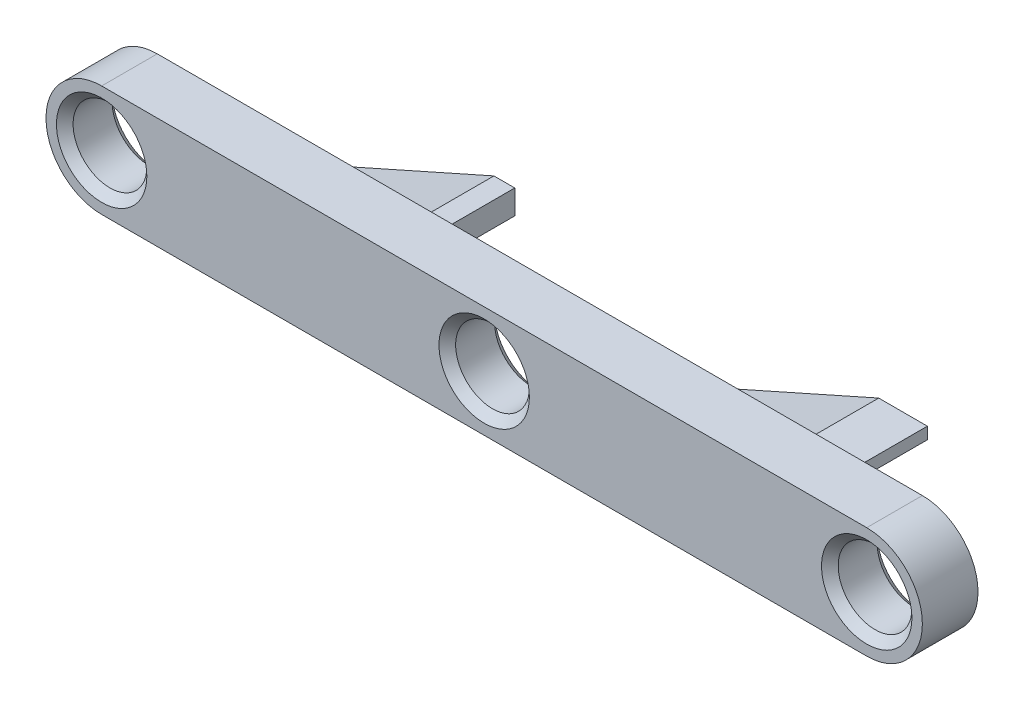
SolidWorks part; units mm, degrees
ref_plane "Alzado" through (0, 0, 0) normal (0, 0, 1) x (1, 0, 0)
ref_plane "Planta" through (0, 0, 0) normal (0, 1, 0) x (1, 0, 0)
ref_plane "Vista lateral" through (0, 0, 0) normal (1, 0, 0) x (0, 0, -1)
sketch "Sketch1" plane through (0, 0, 0) normal (0, 0, 1) x (1, 0, 0)
  line L0 (-27.5, 0) -> (27.5, 0) construction
  line L1 (-27.5, 4) -> (27.5, 4)
  line L2 (-27.5, -4) -> (27.5, -4)
  arc A0 (-27.5, 4) -> (-27.5, -4) centre (-27.5, 0) ccw
  arc A1 (27.5, -4) -> (27.5, 4) centre (27.5, 0) ccw
  point P3 (0, 0)
extrude "Boss-Extrude1" add sketch "Sketch1" along normal blind 4
sketch "Sketch2" plane through (0, 0, 4) normal (0, 0, 1) x (1, 0, 0)
  circle A0 centre (-27.5, 0) radius 2.65
  circle A1 centre (0, 0) radius 2.65
  circle A2 centre (27.5, 0) radius 2.65
extrude "Cut-Extrude1" cut sketch "Sketch2" against normal through all
chamfer "Chamfer2" distance 0.6 angle 45 1 edges at (-24.85, 0, 4)
chamfer "Chamfer3" distance 0.6 angle 45 1 edges at (-24.85, 0, 0)
chamfer "Chamfer4" distance 0.6 angle 45 1 edges at (2.65, 0, 0)
chamfer "Chamfer5" distance 0.6 angle 45 1 edges at (2.65, 0, 4)
chamfer "Chamfer6" distance 0.6 angle 45 1 edges at (30.15, 0, 0)
chamfer "Chamfer7" distance 0.6 angle 45 1 edges at (30.15, 0, 4)
sketch "Sketch5" plane through (0, 0, 0) normal (0, 0, -1) x (-1, 0, 0)
  line L0 (-23.161, 3.8) -> (-23.161, 2.9501)
  line L1 (-23.161, 2.9501) -> (-8, -3.8)
  line L2 (-8, -3.8) -> (-6.5, -3.8)
  line L3 (-6.5, -3.8) -> (-6.5, -2.0596)
  line L4 (-6.5, -2.0596) -> (-19.661, 3.8)
  line L5 (-19.661, 3.8) -> (-23.161, 3.8)
  line L6 (27.5, -4) -> (-27.5, -4) construction
  line L7 (-27.5, 4) -> (27.5, 4) construction
  dimension "D1" = 156
  dimension "D2" = 0.2
  dimension "D3" = 0.2
  dimension "D4" = 2.2
  dimension "D5" = 6.5
  dimension "D6" = 1.5
  dimension "D7" = 3.5
extrude "Boss-Extrude2" add sketch "Sketch5" along normal blind 4.7
mirror "Mirror1" about plane through (0, 0, 0) normal (0, 1, 0) of "Boss-Extrude2"
sketch "Sketch6" plane through (0, 0, -4.7) normal (0, 0, -1) x (-1, 0, 0)
  line L0 (-15.1048, 1.7714) -> (-8.7515, -1.0572)
  line L1 (-13.8305, 1.2041) -> (-19.661, 3.8) construction
  line L2 (-6.5, -2.0596) -> (-11.126, 0) construction
  line L3 (-8.7515, -1.0572) -> (-4.1103, 2.5131)
  line L4 (-4.1103, 2.5131) -> (-7.2468, 7.6014)
  line L5 (-7.2468, 7.6014) -> (-15.1048, 1.7714)
  line L6 (-17.6266, 0.4861) -> (-11.7196, -2.1439)
  line L7 (-23.161, 2.9501) -> (-16.5349, 0) construction
  line L8 (-13.8305, -1.2041) -> (-8, -3.8) construction
  line L9 (-11.7196, -2.1439) -> (-16.6489, -6.3188)
  line L10 (-16.6489, -6.3188) -> (-25.7645, -5.2342)
  line L11 (-25.7645, -5.2342) -> (-21.9821, -0.1889)
  line L12 (-21.9821, -0.1889) -> (-17.6266, 0.4861)
  line L13 (8.5842, 1.1317) -> (14.7037, -1.5929)
  line L14 (6.5, 2.0596) -> (11.126, 0) construction
  line L15 (13.8305, -1.2041) -> (19.661, -3.8) construction
  line L16 (14.7037, -1.5929) -> (6.4424, -5.613)
  line L17 (6.4424, -5.613) -> (4.5258, -0.3828)
  line L18 (4.5258, -0.3828) -> (8.5842, 1.1317)
  line L19 (11.9832, 2.0266) -> (17.7586, -0.5448)
  line L20 (13.8305, 1.2041) -> (8, 3.8) construction
  line L21 (23.161, -2.9501) -> (16.5349, 0) construction
  line L22 (17.7586, -0.5448) -> (24.258, 3.4369)
  line L23 (24.258, 3.4369) -> (16.814, 7.9124)
  line L24 (16.814, 7.9124) -> (11.9832, 2.0266)
extrude "Cut-Extrude2" cut sketch "Sketch6" against normal up to surface (4.7 mm away)
equation "\"largo\"= 55"
equation "\"ancho\"= 8"
equation "\"thick_c\"= 1.5"
equation "\"c\"= 5.3"
equation "\"chan_1\"= 0.6"
equation "\"D1@Sketch1\"=\"largo\""
equation "\"D1@Boss-Extrude1\"=\"thick\""
equation "\"D1@Sketch2\"=\"largo\"/2"
equation "\"D2@Sketch2\"=\"largo\"/2"
equation "\"thick\"= 4"
equation "\"D3@Sketch2\"=\"c\""
equation "\"D4@Sketch2\"=\"c\""
equation "\"D5@Sketch2\"=\"c\""
equation "\"D1@Chamfer2\"=\"chan_1\""
equation "\"D1@Chamfer4\"=\"chan_1\""
equation "\"D1@Chamfer5\"=\"chan_1\""
equation "\"D1@Chamfer6\"=\"chan_1\""
equation "\"D1@Chamfer7\"=\"chan_1\""
equation "\"D2@Sketch1\"=\"ancho\""
equation "\"D1@Chamfer3\"=\"chan_1\""
